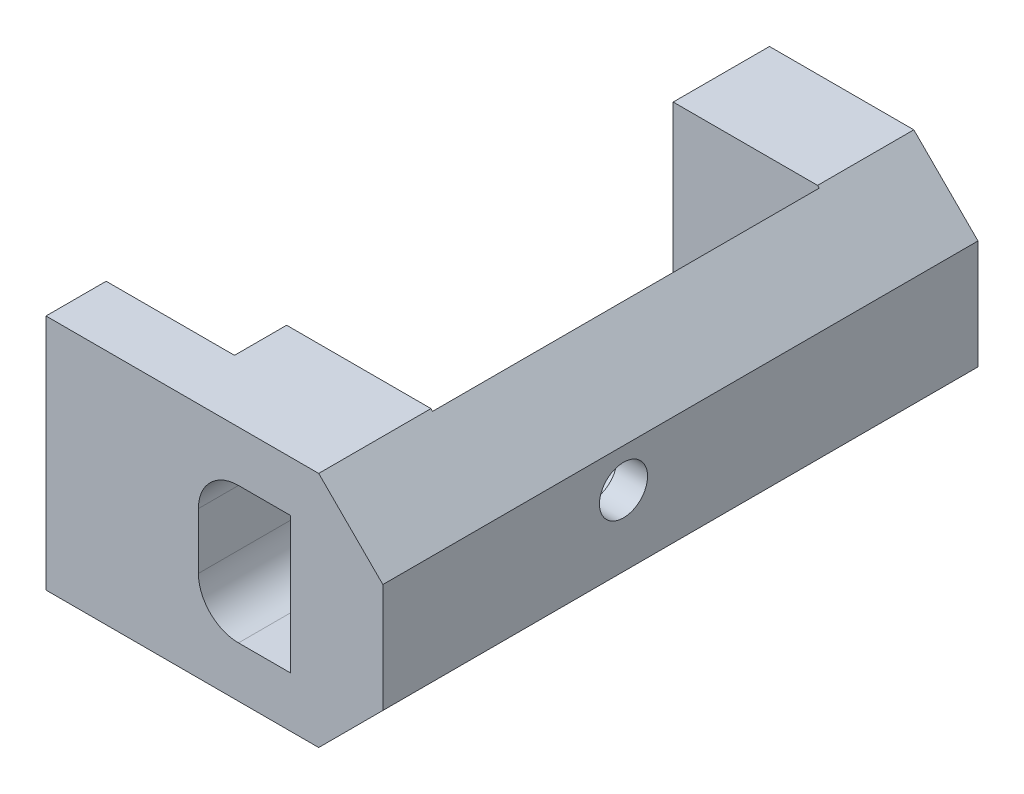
SolidWorks part; units mm, degrees
ref_plane "Front" through (0, 0, 0) normal (0, 0, 1) x (1, 0, 0)
ref_plane "Top" through (0, 0, 0) normal (0, 1, 0) x (1, 0, 0)
ref_plane "Right" through (0, 0, 0) normal (1, 0, 0) x (0, 0, -1)
sketch "Sketch1" plane through (0, 0, 0) normal (0, 1, 0) x (1, 0, 0)
  line L0 (0, 0) -> (13, 0)
  line L1 (13, 0) -> (13, 33.1)
  line L2 (0, 0) -> (0, 5)
  line L3 (0, 5) -> (9.1, 5)
  line L4 (9.1, 5) -> (9.1, 28.1)
  line L5 (13, 16.55) -> (-7.0543, 16.55) construction
  line L6 (0, 28.1) -> (9.1, 28.1)
  line L7 (0, 33.1) -> (0, 28.1)
  line L8 (0, 33.1) -> (13, 33.1)
  point P12 (9.1, 16.55)
  dimension "D1" = 5
  dimension "D2" = 13
  dimension "D3" = 9.1
  dimension "D4" = 16.55
extrude "Boss-Extrude1" add sketch "Sketch1" along normal blind 14.8
sketch "Sketch3" plane through (13, 0, 0) normal (1, 0, 0) x (0, 0, -1)
  line L0 (28.1, 0) -> (5, 0) construction
  line L1 (0, 14.8) -> (0, 0) construction
  circle A0 centre (12, 8.4) radius 1.5
  dimension "D1" = 3
  dimension "D2" = 12
  dimension "D3" = 8.4
extrude "Cut-Extrude2" cut sketch "Sketch3" against normal blind 10
sketch "Sketch5" plane through (9.1, 0, 0) normal (-1, 0, 0) x (0, 0, 1)
  line L1 (-11.7386, 11.6896) -> (-14.7182, 10.2712)
  line L2 (-14.7182, 10.2712) -> (-14.9796, 6.9815)
  line L3 (-14.9796, 6.9815) -> (-12.2614, 5.1104)
  line L4 (-12.2614, 5.1104) -> (-9.2818, 6.5288)
  line L5 (-9.2818, 6.5288) -> (-9.0204, 9.8185)
  line L6 (-9.0204, 9.8185) -> (-11.7386, 11.6896)
  circle A0 centre (-12, 8.4) radius 2.8579 construction
  dimension "D1" = 6.6
extrude "Cut-Extrude4" cut sketch "Sketch5" against normal blind 2
chamfer "Chamfer1" distance 4 angle 45 2 edges at (13, 14.8, -16.55) (13, 0, -16.55)
sketch "Sketch7" plane through (0, 0, 0) normal (0, 0, 1) x (1, 0, 0)
  line L0 (0, 0) -> (9, 0)
  line L1 (9, 0) -> (13, 4)
  line L2 (13, 4) -> (13, 10.8)
  line L3 (13, 10.8) -> (9, 14.8)
  line L4 (9, 14.8) -> (0, 14.8)
  line L5 (0, 14.8) -> (0, 0)
extrude "Boss-Extrude2" add sketch "Sketch7" along normal blind 3
sketch "Sketch6" plane through (0, 0, 0) normal (-1, 0, 0) x (0, 0, 1)
  line L0 (-5, 14.8) -> (3, 14.8) construction
  line L1 (-5, 0) -> (-0.75, 0)
  line L2 (-5, 0) -> (-5, 14.8)
  line L3 (-5, 14.8) -> (-0.75, 14.8)
  line L4 (-0.75, 0) -> (-0.75, 14.8)
  line L9 (-0.75, 0) -> (-0.75, 14.8)
  line L10 (-0.75, 14.8) -> (3, 14.8)
  line L11 (-0.75, 14.8) -> (-0.75, 0)
  line L12 (-0.75, 0) -> (3, 0)
  line L13 (3, 14.8) -> (3, 0)
  dimension "D1" = 4.25
extrude "Boss-Extrude3" add sketch "Sketch6" along normal blind 8 contours L4 M2 M15 M4
sketch "Sketch8" plane through (0, 0, 3) normal (0, 0, 1) x (1, 0, 0)
  line L0 (-8, 0) -> (9, 0) construction
  line L5 (7.25, 11.65) -> (7.25, 3.15)
  line L6 (7.25, 3.15) -> (4, 3.15)
  line L7 (1.5, 9.15) -> (1.5, 5.65)
  line L8 (7.25, 11.65) -> (4, 11.65)
  line L10 (13, 4) -> (13, 10.8) construction
  arc A0 (4, 11.65) -> (1.5, 9.15) centre (4, 9.15) ccw
  arc A1 (1.5, 5.65) -> (4, 3.15) centre (4, 5.65) ccw
  point P12 (1.5, 3.15)
  dimension "D5" = 2.5
  dimension "D1" = 8.5
  dimension "D2" = 3.15
  dimension "D3" = 5.75
  dimension "D4" = 5.75
extrude "Cut-Extrude7" cut sketch "Sketch8" against normal blind 8
sketch "Sketch10" plane through (0, 0, -33.1) normal (0, 0, -1) x (-1, 0, 0)
  line L0 (0, 14.8) -> (0, 0)
  line L1 (0, 0) -> (-9, 0)
  line L2 (-9, 0) -> (-13, 4)
  line L3 (-13, 4) -> (-13, 10.8)
  line L4 (-13, 10.8) -> (-9, 14.8)
  line L5 (-9, 14.8) -> (0, 14.8)
extrude "Boss-Extrude4" add sketch "Sketch10" along normal blind 1
sketch "Sketch11" plane through (0, 0, 0) normal (-1, 0, 0) x (0, 0, 1)
  circle A0 centre (-31.1, 8.4) radius 1
  dimension "D1" = 2
extrude "Cut-Extrude8" cut sketch "Sketch11" against normal blind 6
sketch "Sketch12" plane through (0, 0, -5) normal (0, 0, -1) x (-1, 0, 0)
  line L0 (0, 0) -> (0, 14.8)
  line L1 (0, 14.8) -> (-9, 14.8)
  line L2 (-9, 14.8) -> (-9.1, 14.7)
  line L3 (-9.1, 14.7) -> (-9.1, 0.1)
  line L4 (-9.1, 0.1) -> (-9, 0)
  line L5 (-9, 0) -> (0, 0)
extrude "Cut-Extrude9" cut sketch "Sketch12" against normal blind 1
